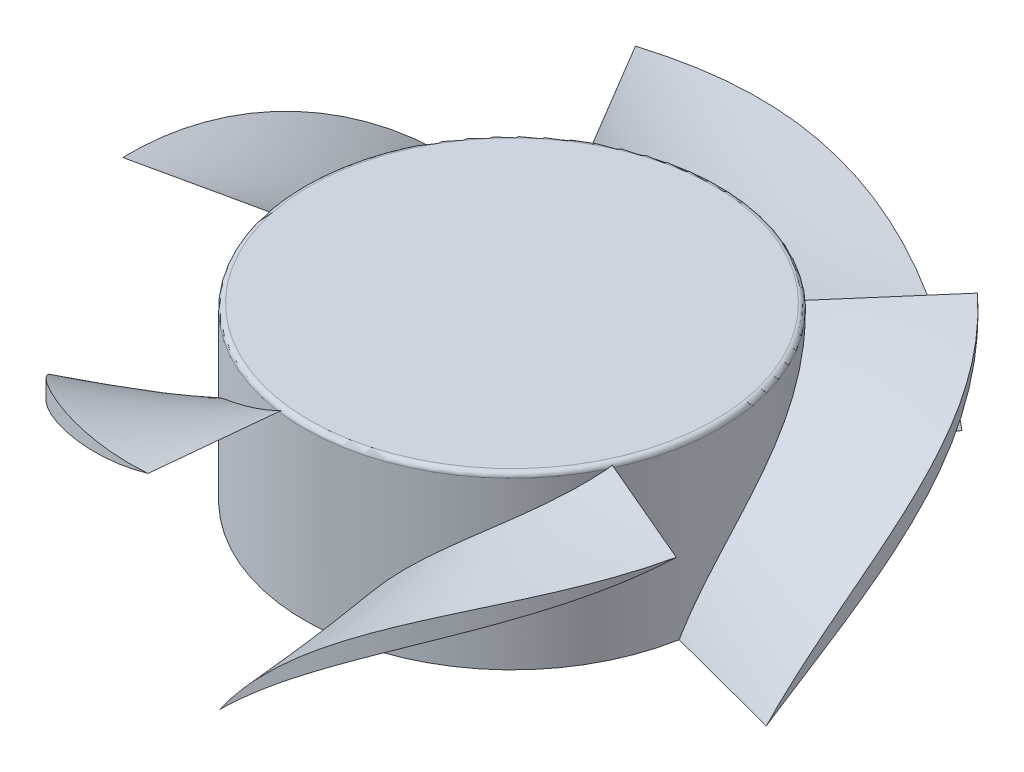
SolidWorks part; units mm, degrees
ref_plane "前基準面" through (0, 0, 0) normal (0, 0, 1) x (1, 0, 0)
ref_plane "上基準面" through (0, 0, 0) normal (0, 1, 0) x (1, 0, 0)
ref_plane "右基準面" through (0, 0, 0) normal (1, 0, 0) x (0, 0, -1)
sketch "Sketch1" plane through (0, 0, 0) normal (0, 1, 0) x (1, 0, 0)
  circle A0 centre (0, 0) radius 8.5
extrude "Boss-Extrude1" add sketch "Sketch1" along normal blind 7
sketch "Sketch2" plane through (0, 7, 0) normal (0, 1, 0) x (1, 0, 0)
  line L2 (-6.75, 11.6913) -> (0, 0)
  line L3 (0, 0) -> (6.75, 11.6913)
  line L4 (4.25, 7.3612) -> (-4.25, 7.3612) construction
  line L5 (6.75, 11.6913) -> (7.8903, 13.6664) construction
  line L6 (-6.75, 11.6913) -> (-7.9117, 13.7034) construction
  line L9 (0, 0) -> (-11.7052, 16.1108)
  line L10 (0, 0) -> (11.7052, 16.1108)
  line L11 (11.7052, 16.1108) -> (-11.7052, 16.1108)
  arc A0 (-6.75, 11.6913) -> (6.75, 11.6913) centre (0, 0) cw
  circle A3 centre (0, 0) radius 8.5 construction
  point P5 (0, 13.5)
  point P9 (0, 16.1108)
  point P12 (0, 7.3612)
  point P13 (0, 0)
  dimension "D2" = 13.5
  dimension "D1" = 60
  dimension "D3" = 72
ref_plane "Plane2" through (0, 0, -7.3612) normal (0, 0, 1) x (1, 0, 0)
sketch "Sketch3" plane through (0, 0, -7.3612) normal (0, 0, 1) x (1, 0, 0)
  line L0 (9.35, 0) -> (-9.35, 0) construction
  spline S0 degree 2 poles (-4.083, 6.89) (1.7455, 4.0431) (3.9464, 0) knots 0 0 0 1 1 1
  spline S1 degree 2 poles (3.9464, 0) (1.3357, 3.0793) (-4.083, 6.89) knots 0 0 0 1 1 1
  point P2 (4.25, 7)
  point P3 (-4.25, 7)
  point P6 (3.9464, 6.8463)
  point P7 (3.9464, 4.792)
  point P10 (3.9464, 7)
  point P11 (-3.9464, 0)
  point P12 (0, 0)
  point P13 (3.6714, 7)
  point P14 (3.9464, 0)
  point P15 (-3.9464, 0)
  point P16 (-3.9464, 6.4399)
  dimension "D1" = 0.2
ref_plane "Plane1" through (0, 0, -13.5) normal (0, 0, 1) x (1, 0, 0)
sketch "Sketch4" plane through (0, 0, -13.5) normal (0, 0, 1) x (1, 0, 0)
  line L3 (9.35, 0) -> (-9.35, 0) construction
  spline S0 degree 2 poles (7.8903, 0) (2.4898, 6.0762) (-7.7231, 6.9333) knots 0 0 0 1 1 1
  spline S1 degree 2 poles (7.8903, 0) (1.7942, 4.7602) (-7.7231, 6.9333) knots 0 0 0 1 1 1
  point P0 (7.3267, 0)
  point P2 (6.4178, 7)
  point P3 (5.9767, 7)
  point P5 (7.8903, 0)
  point P8 (-7.9117, 7)
  point P9 (7.8903, 7)
  point P10 (6.4032, 7)
  dimension "D1" = 0.2
loft "Loft5" add profiles "Sketch4", "Sketch3"
extrude "Cut-Extrude1" cut sketch "Sketch2" against normal through all
pattern_circular "CirPattern1" count 5 every 72 about axis through (0, 7, 0) along (0, 1, 0) of "Loft5", "Cut-Extrude1"
fillet "Fillet1" radius 0.2 1 edges at (0, 7, 8.5)
